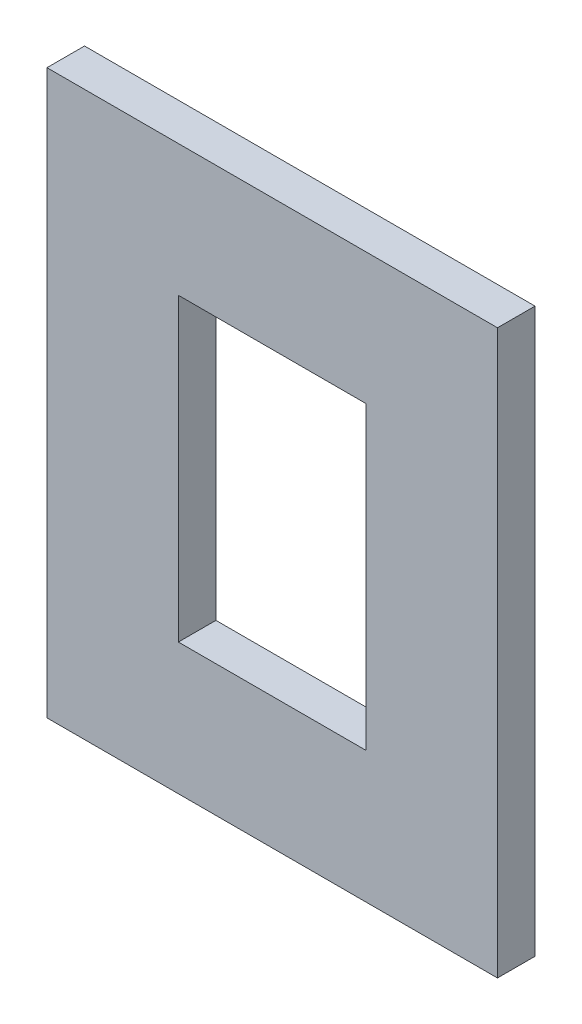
SolidWorks part; units mm, degrees
ref_plane "Front Plane" through (0, 0, 0) normal (0, 0, 1) x (1, 0, 0)
ref_plane "Top Plane" through (0, 0, 0) normal (0, 1, 0) x (1, 0, 0)
ref_plane "Right Plane" through (0, 0, 0) normal (1, 0, 0) x (0, 0, -1)
sketch "Sketch2" plane through (0, 0, 0) normal (0, 0, 1) x (1, 0, 0)
  line L1 (31.75, -50.8) -> (-31.75, -50.8)
  line L2 (31.75, -50.8) -> (31.75, 50.8)
  line L3 (31.75, 50.8) -> (-31.75, 50.8)
  line L4 (-31.75, -50.8) -> (-31.75, 50.8)
  line L5 (31.75, -50.8) -> (-31.75, 50.8) construction
  line L6 (31.75, 50.8) -> (-31.75, -50.8) construction
  line L9 (76.2, -95.25) -> (-76.2, -95.25)
  line L11 (-76.2, -95.25) -> (-76.2, 95.25)
  line L13 (-76.2, 95.25) -> (76.2, 95.25)
  line L15 (76.2, 95.25) -> (76.2, -95.25)
  point P0 (0, 0)
  point P6 (76.2, 0)
  point P7 (-76.2, 0)
  point P8 (0, 95.25)
  point P9 (0, -95.25)
  dimension "D1" = 63.5
  dimension "D2" = 101.6
  dimension "D3" = 190.5
  dimension "D4" = 152.4
extrude "Boss-Extrude2" add sketch "Sketch2" against normal blind 12.7
